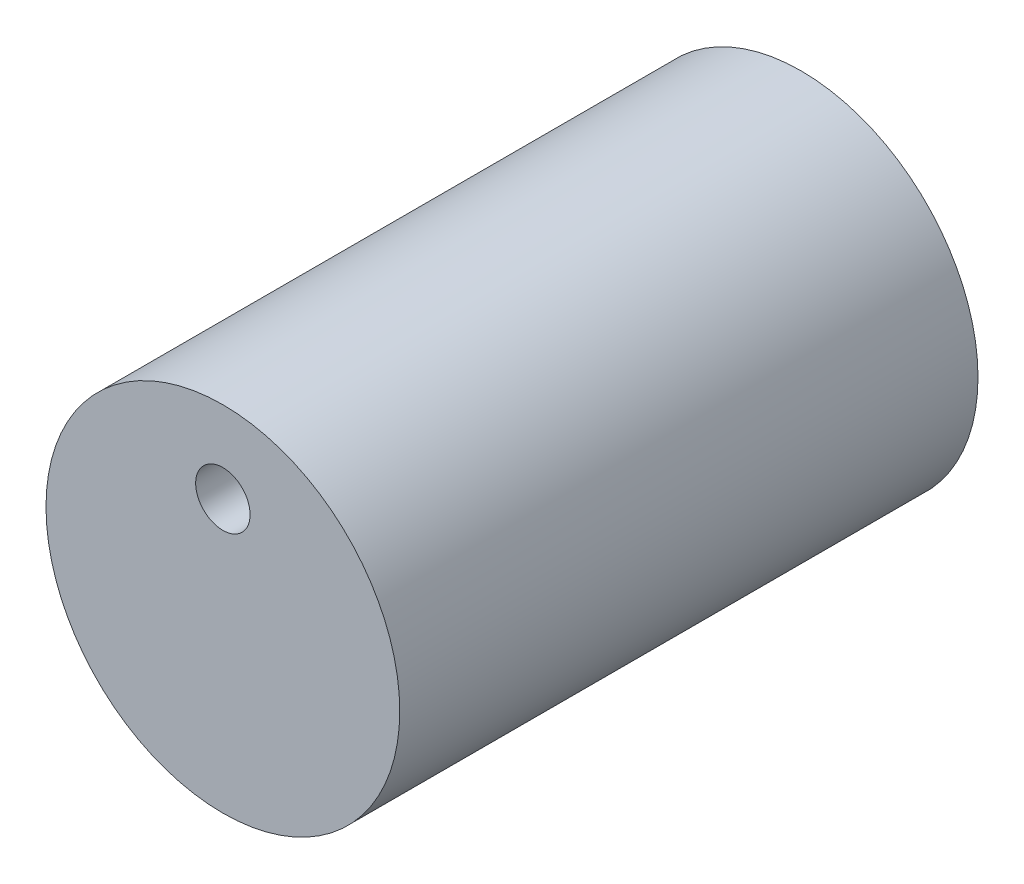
SolidWorks part; units mm, degrees
ref_plane "正面" through (0, 0, 0) normal (0, 0, 1) x (1, 0, 0)
ref_plane "平面" through (0, 0, 0) normal (0, 1, 0) x (1, 0, 0)
ref_plane "右側面" through (0, 0, 0) normal (1, 0, 0) x (0, 0, -1)
sketch "ｽｹｯﾁ1" plane through (0, 0, 0) normal (0, 0, 1) x (1, 0, 0)
  circle A0 centre (0, 0) radius 13
  dimension "D1" = 26
extrude "ﾎﾞｽ - 押し出し1" add sketch "ｽｹｯﾁ1" along normal blind 42.5
sketch "ｽｹｯﾁ2" plane through (0, 0, 42.5) normal (0, 0, 1) x (1, 0, 0)
  line L0 (0, 0) -> (0, 7) construction
  line L1 (0, 7) -> (0, 9) construction
  line L2 (0, 9) -> (0, 13) construction
  circle A0 centre (0, 7) radius 2
  circle A1 centre (0, 0) radius 13 construction
  dimension "D1" = 4
  dimension "D2" = 4
extrude "ｶｯﾄ - 押し出し1" cut sketch "ｽｹｯﾁ2" against normal blind 4.7
sketch "ｽｹｯﾁ3" plane through (0, 0, 0) normal (0, 0, -1) x (-1, 0, 0)
  line L0 (0, 0) -> (0, 7.5) construction
  line L1 (0, 7.5) -> (0, 13) construction
  circle A0 centre (0, 6) radius 1.5
  circle A1 centre (0, 0) radius 13 construction
  dimension "D1" = 3
  dimension "D2" = 5.5
extrude "ｶｯﾄ - 押し出し2" cut sketch "ｽｹｯﾁ3" against normal blind 4
